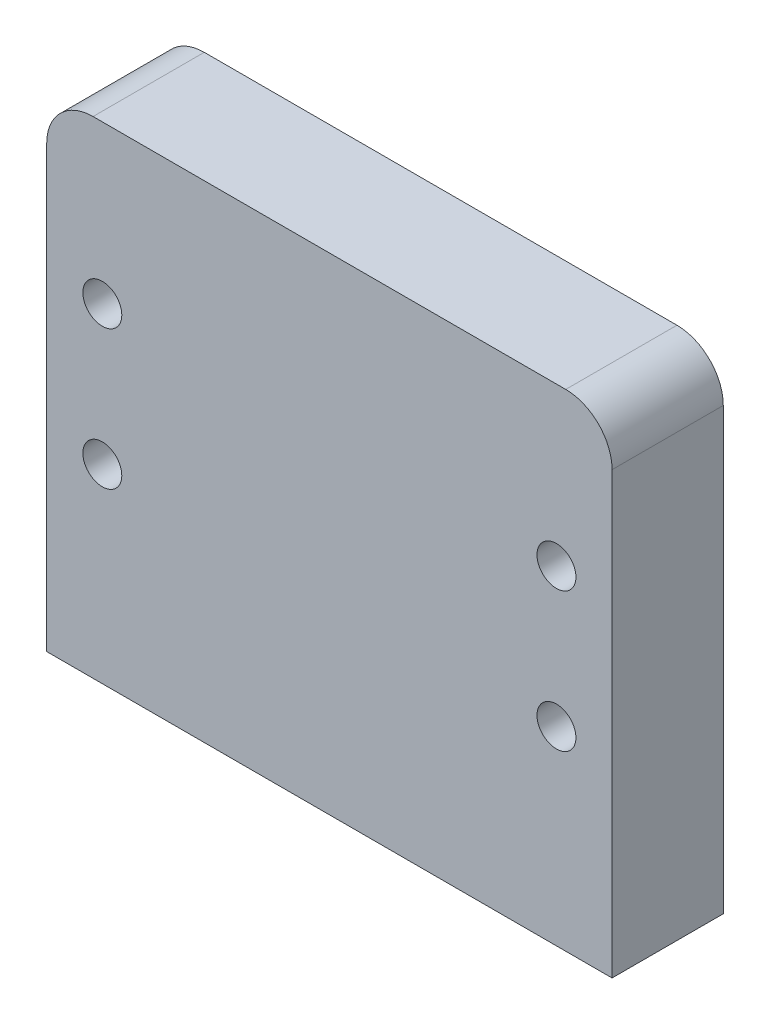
SolidWorks part; units mm, degrees
ref_plane "Ebene vorne" through (0, 0, 0) normal (0, 0, 1) x (1, 0, 0)
ref_plane "Ebene oben" through (0, 0, 0) normal (0, 1, 0) x (1, 0, 0)
ref_plane "Ebene rechts" through (0, 0, 0) normal (1, 0, 0) x (0, 0, -1)
sketch "Skizze1" plane through (0, 0, 0) normal (0, 0, 1) x (1, 0, 0)
  line L1 (-30.5, 0) -> (30.5, 0)
  line L2 (-30.5, 0) -> (-30.5, 52.5)
  line L3 (-30.5, 52.5) -> (30.5, 52.5)
  line L4 (30.5, 0) -> (30.5, 52.5)
  point P4 (0, 0)
  dimension "D1" = 52.5
  dimension "D2" = 61
extrude "Linear austragen1" add sketch "Skizze1" along normal blind 12
fillet "Verrundung1" radius 5 2 edges at (30.5, 52.5, 6) (-30.5, 52.5, 6)
hole_wizard "M5 Gewindebohrung1" positions "Skizze10" profile "Skizze9" tap size "M5" standard "DIN"
sketch "Skizze10" plane through (4.843, 20.9772, 12) normal (0, 0, -1) x (-1, 0, 0)
  line L0 (35.343, -20.9772) -> (-25.657, -20.9772) construction
  line L1 (4.843, -20.9772) -> (4.843, 31.5228) construction
  line L2 (-20.657, 31.5228) -> (30.343, 31.5228) construction
  point P0 (29.343, 14.5228)
  point P3 (29.343, -0.4772)
  point P15 (-19.657, -0.4772)
  point P16 (-19.657, 14.5228)
  dimension "D1" = 20.5
  dimension "D2" = 15
  dimension "D3" = 24.5
sketch "Skizze9" plane through (-24.5, 35.5, 12) normal (1, 0, 0) x (0, -1, 0)
  line L0 (0, 0) -> (0, 15.2618)
  line L1 (0, 15.2618) -> (2.1, 14)
  line L2 (2.1, 14) -> (2.1, 0)
  line L5 (2.1, 0) -> (0, 0)
  line L10 (0, 15.2618) -> (-2.1, 14) construction
  line L11 (0, -6.35) -> (0, 107.95) construction
  dimension "Bohrerdurchmesser" = 4.2
  dimension "Bohrungstiefe" = 14
  dimension "Spitzenwinkel" = 118
